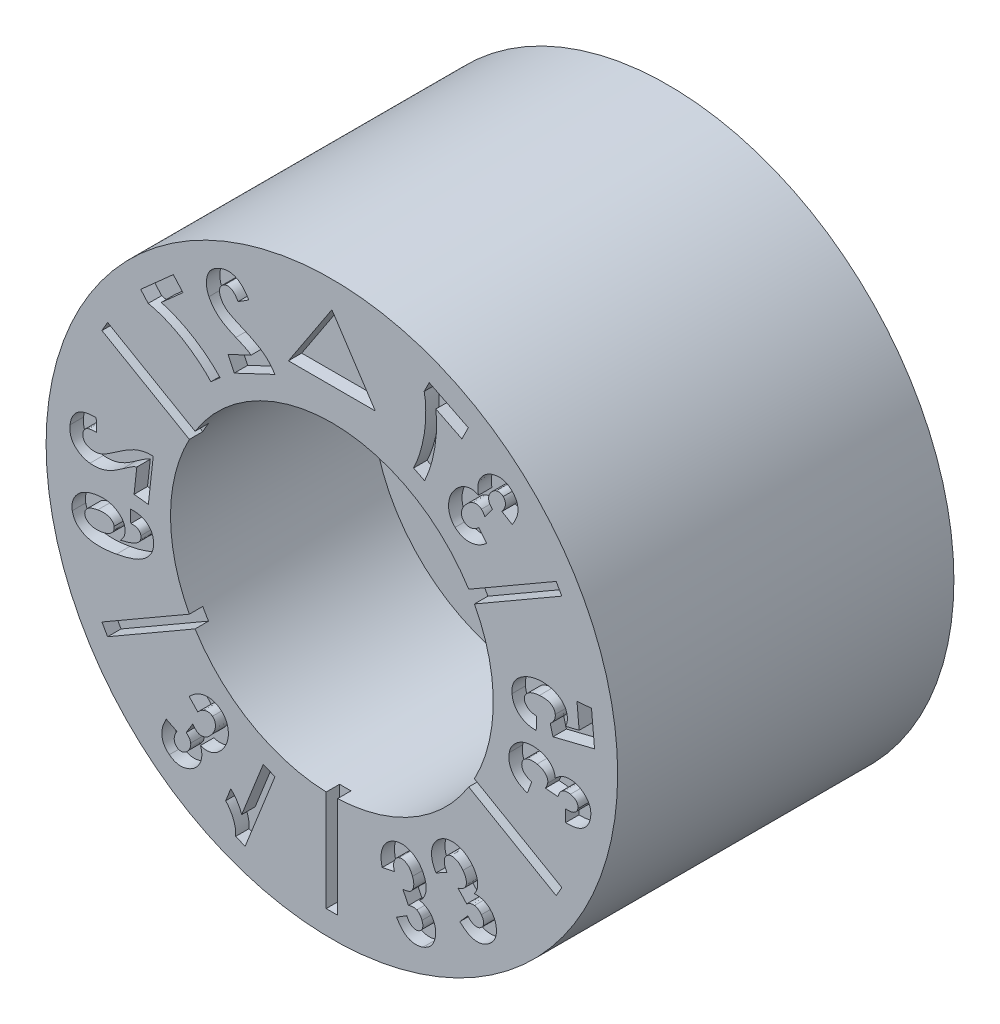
SolidWorks part; units mm, degrees
ref_plane "Front Plane" through (0, 0, 0) normal (0, 0, 1) x (1, 0, 0)
ref_plane "Top Plane" through (0, 0, 0) normal (0, 1, 0) x (1, 0, 0)
ref_plane "Right Plane" through (0, 0, 0) normal (1, 0, 0) x (0, 0, -1)
imported_body "Imported1"
other "Move Face1" parameters "D1"=0.18
other "DeleteFace1"
sketch "Sketch1" plane through (0, 0, 0) normal (0, 0, 1) x (1, 0, 0)
  line L0 (0, 0) -> (0, -4.8695) construction
  line L1 (0, 0) -> (-2.4347, -4.2171) construction
  line L2 (-0.085, -2.3069) -> (0.085, -2.3069)
  line L3 (-0.085, -2.3069) -> (-0.085, -3.9)
  line L4 (-0.085, -3.9) -> (0.085, -3.9)
  line L5 (0.085, -2.3069) -> (0.085, -3.9)
  line L10 (0, 0) -> (-4.2171, -2.4347) construction
  line L11 (-1.9553, -1.2271) -> (-3.335, -2.0236)
  line L12 (-2.0403, -1.0798) -> (-3.42, -1.8764)
  line L13 (-3.42, -1.8764) -> (-3.335, -2.0236)
  line L14 (-2.0403, -1.0798) -> (-1.9553, -1.2271)
  line L15 (0, 0) -> (-4.8695, 0) construction
  line L20 (0, 0) -> (-4.2171, 2.4347) construction
  line L21 (-2.0403, 1.0798) -> (-3.42, 1.8764)
  line L22 (-1.9553, 1.2271) -> (-3.335, 2.0236)
  line L23 (-3.335, 2.0236) -> (-3.42, 1.8764)
  line L24 (-1.9553, 1.2271) -> (-2.0403, 1.0798)
  line L25 (0, 0) -> (-2.4347, 4.2171) construction
  line L30 (0, 0) -> (0, 4.8695) construction
  line L35 (0, 0) -> (2.4347, 4.2171) construction
  line L40 (0, 0) -> (4.2171, 2.4347) construction
  line L41 (1.9553, 1.2271) -> (3.335, 2.0236)
  line L42 (2.0403, 1.0798) -> (3.42, 1.8764)
  line L43 (3.42, 1.8764) -> (3.335, 2.0236)
  line L44 (2.0403, 1.0798) -> (1.9553, 1.2271)
  line L45 (0, 0) -> (4.8695, 0) construction
  line L50 (0, 0) -> (4.2171, -2.4347) construction
  line L51 (2.0403, -1.0798) -> (3.42, -1.8764)
  line L52 (1.9553, -1.2271) -> (3.335, -2.0236)
  line L53 (3.335, -2.0236) -> (3.42, -1.8764)
  line L54 (1.9553, -1.2271) -> (2.0403, -1.0798)
  line L55 (0, 0) -> (2.4347, -4.2171) construction
  line L101 (0.085, 3.9) -> (-0.085, 3.9)
  line L102 (0.085, 2.3069) -> (0.085, 3.9)
  line L103 (-0.085, 2.3069) -> (-0.085, 3.9)
  line L104 (0.085, 2.3069) -> (-0.085, 2.3069)
  line L105 (1.0798, 2.0403) -> (1.8764, 3.42)
  line L106 (1.2271, 1.9553) -> (2.0236, 3.335)
  line L107 (2.0236, 3.335) -> (1.8764, 3.42)
  line L108 (1.2271, 1.9553) -> (1.0798, 2.0403)
  line L109 (-1.0798, 2.0403) -> (-1.2271, 1.9553)
  line L110 (-1.0798, 2.0403) -> (-1.8764, 3.42)
  line L111 (-1.2271, 1.9553) -> (-2.0236, 3.335)
  line L112 (-1.8764, 3.42) -> (-2.0236, 3.335)
  line L113 (-2.3069, 0.085) -> (-3.9, 0.085)
  line L114 (-2.3069, -0.085) -> (-3.9, -0.085)
  line L115 (-3.9, 0.085) -> (-3.9, -0.085)
  line L116 (-2.3069, 0.085) -> (-2.3069, -0.085)
  line L117 (2.3069, 0.085) -> (3.9, 0.085)
  line L118 (2.3069, -0.085) -> (3.9, -0.085)
  line L119 (3.9, -0.085) -> (3.9, 0.085)
  line L120 (2.3069, -0.085) -> (2.3069, 0.085)
  line L121 (-1.0798, -2.0403) -> (-1.8764, -3.42)
  line L122 (-1.2271, -1.9553) -> (-2.0236, -3.335)
  line L123 (-1.2271, -1.9553) -> (-1.0798, -2.0403)
  line L124 (-2.0236, -3.335) -> (-1.8764, -3.42)
  line L125 (1.2271, -1.9553) -> (2.0236, -3.335)
  line L126 (1.0798, -2.0403) -> (1.8764, -3.42)
  line L127 (1.0798, -2.0403) -> (1.2271, -1.9553)
  line L128 (1.8764, -3.42) -> (2.0236, -3.335)
  arc A1 (-0.8173, 2.6127) -> (0, 2.7376) centre (0, 0) ccw construction
  text T0 "27   29   31   33   35   37" font "Arial Narrow" height 1.2
  point P10 (0, 0)
  point P21 (0, 0)
  point P69 (0, 0)
  dimension "D5" = 12
  dimension "D1" = 2.7376
extrude "Cut-Extrude1" cut sketch "Sketch1" against normal blind 0.2
